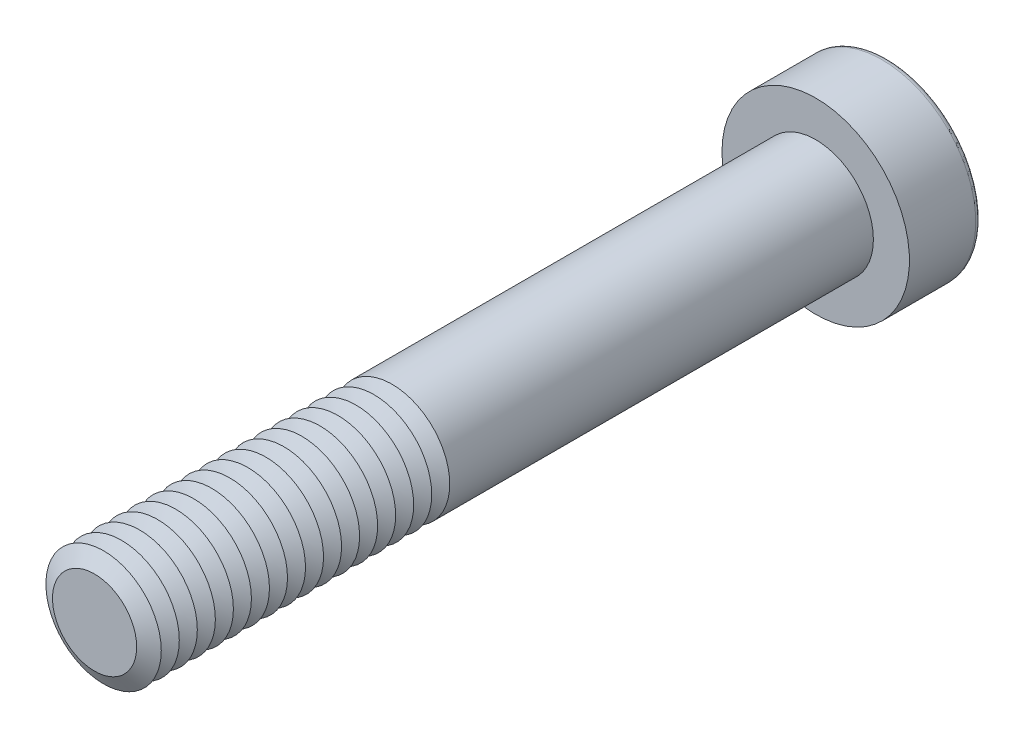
SolidWorks part; units mm, degrees
ref_plane "Front Plane" through (0, 0, 0) normal (0, 0, 1) x (1, 0, 0)
ref_plane "Top Plane" through (0, 0, 0) normal (0, 1, 0) x (1, 0, 0)
ref_plane "Right Plane" through (0, 0, 0) normal (1, 0, 0) x (0, 0, -1)
sketch "Sketch1" plane through (0, 0, 0) normal (0, 0, 1) x (1, 0, 0)
  circle A0 centre (0, 0) radius 4
  dimension "D1" = 8
extrude "Boss-Extrude1" add sketch "Sketch1" along normal blind 50
sketch "Sketch2" plane through (0, 0, 0) normal (0, 0, -1) x (-1, 0, 0)
  circle A0 centre (0, 0) radius 6.5
  dimension "D1" = 13
extrude "Boss-Extrude2" add sketch "Sketch2" along normal blind 5
sketch "Sketch3" plane through (0, 0, -5) normal (0, 0, -1) x (-1, 0, 0)
  line L1 (-1.4434, 2.5) -> (-2.8868, 0)
  line L2 (-2.8868, 0) -> (-1.4434, -2.5)
  line L3 (-1.4434, -2.5) -> (1.4434, -2.5)
  line L4 (1.4434, -2.5) -> (2.8868, 0)
  line L5 (2.8868, 0) -> (1.4434, 2.5)
  line L6 (1.4434, 2.5) -> (-1.4434, 2.5)
  circle A0 centre (0, 0) radius 2.5 construction
  dimension "D1" = 5
extrude "Cut-Extrude1" cut sketch "Sketch3" against normal blind 3.75
fillet "Fillet1" radius 0.4 1 edges at (-6.5, 0, -5)
sketch "Sketch4" plane through (0, 0, -1.25) normal (0, 0, -1) x (-1, 0, 0)
  line L0 (1.4434, -2.5) -> (2.8868, 0) construction
  circle A0 centre (0, 0) radius 2.5
extrude "Cut-Extrude2" cut sketch "Sketch4" against normal through all draft 60
sketch "Sketch5" plane through (0, 0, -5) normal (0, 0, -1) x (-1, 0, 0)
  circle A0 centre (0, 0) radius 2.8868
extrude "Cut-Extrude3" cut sketch "Sketch5" against normal through all draft 75
sketch "Sketch7" plane through (0, 0, 0) normal (1, 0, 0) x (0, 0, -1)
  line L25 (-50, 2.9175) -> (-49.375, 4)
  line L26 (-50, 4) -> (-50, -4) construction
  line L27 (-49.375, 4) -> (-50.625, 4)
  line L28 (-50.625, 4) -> (-50, 2.9175)
  line L29 (0, 4) -> (-50, 4) construction
  dimension "D1" = 1.25
revolve "Cut-Revolve1" cut sketch "Sketch7" angle 360 about axis through (0, 0, 50) along (0, 0, -1)
pattern_linear "LPattern1" count 17 spacing 1.25 along (0, 0, -1) of "Cut-Revolve1"
